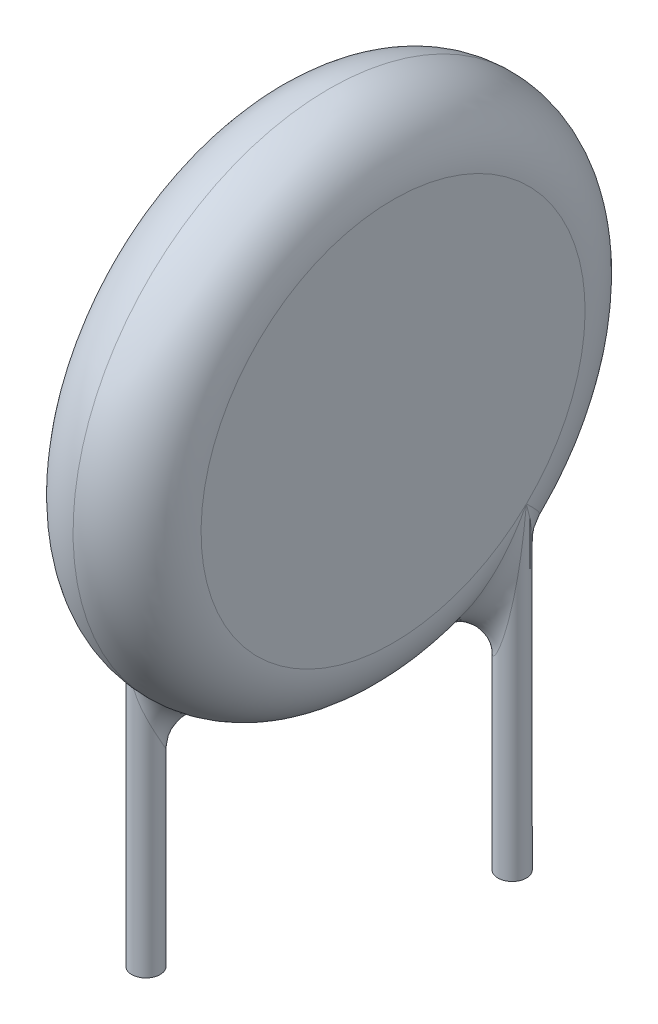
SolidWorks part; units mm, degrees
ref_plane "Front Plane" through (0, 0, 0) normal (0, 0, 1) x (1, 0, 0)
ref_plane "Top Plane" through (0, 0, 0) normal (0, 1, 0) x (1, 0, 0)
ref_plane "Right Plane" through (0, 0, 0) normal (1, 0, 0) x (0, 0, -1)
body saved out of another part "Stock-PSU-1"
scale "Scale1" scale about centroid uniform scaling yes scale factor 0.5
